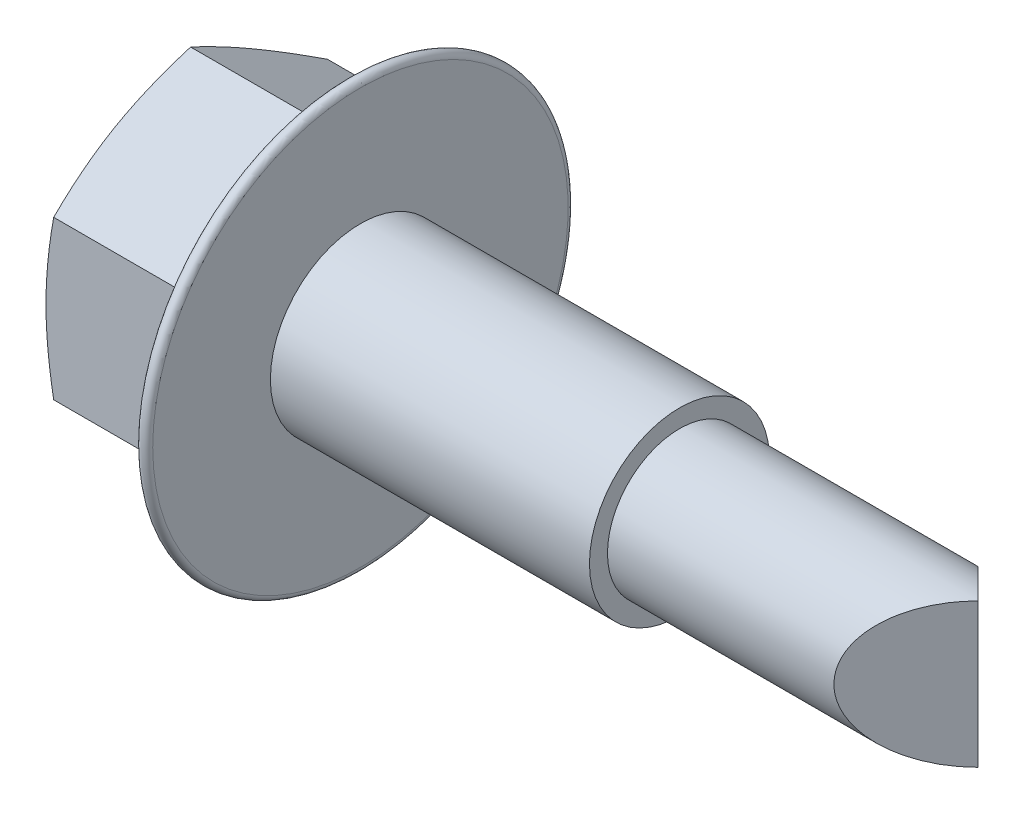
SolidWorks part; units mm, degrees
ref_plane "Front" through (0, 0, 0) normal (0, 0, 1) x (1, 0, 0)
ref_plane "Top" through (0, 0, 0) normal (0, 1, 0) x (1, 0, 0)
ref_plane "Right" through (0, 0, 0) normal (1, 0, 0) x (0, 0, -1)
sketch "Sketch1" plane through (0, 0, 0) normal (0, 0, 1) x (1, 0, 0)
  line L0 (-5.817, 0) -> (26.9196, 0) construction
  line L1 (0, 0) -> (0, 1.75)
  line L2 (0, 1.75) -> (6.2, 1.75)
  line L3 (6.2, 1.75) -> (6.2, 1.4)
  line L4 (6.2, 1.4) -> (12, 1.4)
  line L5 (12, 1.4) -> (12, 0)
  line L6 (12, 0) -> (0, 0)
  line L7 (1.3, 4.1877) -> (1.3, -5.1194) construction
  dimension "lg" = 6.2
  dimension "l" = 12
  dimension "d" = 3.5
  dimension "dp" = 2.8
  dimension "a" = 1.3
revolve "BaseBody" add sketch "Sketch1" angle 360 about L0
sketch "Sketch2" plane through (0, 0, 0) normal (0, 1, 0) x (1, 0, 0)
  line L0 (11.6965, 0) -> (13.6929, 0) construction
  line L2 (12.4565, -10) -> (12.4565, 10)
  line L3 (12.4565, 10) -> (2, 10)
  line L4 (2, 10) -> (12, 0)
  line L6 (2, -10) -> (12, 0)
  line L7 (12.4565, -10) -> (2, -10)
  line L8 (12, -1.4) -> (12, 1.4) construction
  point P12 (12.4565, 0)
  dimension "D1" = 45
  dimension "D2" = 10
  dimension "D3" = 0.4565
extrude "Cut-Extrude1" cut sketch "Sketch2" against normal through all and the other way through all
sketch "Sketch3" plane through (0, 0, 0) normal (1, 0, 0) x (0, 0, -1)
  line L1 (0, -3.0715) -> (2.66, -1.5358)
  line L2 (2.66, -1.5358) -> (2.66, 1.5358)
  line L3 (2.66, 1.5358) -> (0, 3.0715)
  line L4 (0, 3.0715) -> (-2.66, 1.5358)
  line L5 (-2.66, 1.5358) -> (-2.66, -1.5358)
  line L6 (-2.66, -1.5358) -> (0, -3.0715)
  circle A0 centre (0, 0) radius 2.66 construction
  dimension "D1" = 5.32
extrude "BaseHead" add sketch "Sketch3" against normal blind 3.45
sketch "Sketch4" plane through (0, 0, 0) normal (0, 1, 0) x (1, 0, 0)
  line L0 (-3.45, 15) -> (-3.45, 2.66)
  line L1 (-3.45, 2.66) -> (1.0414, 15)
  line L2 (1.0414, 15) -> (-3.45, 15)
  line L3 (0, 0) -> (-8.4371, 0) construction
  line L6 (-3.45, 0) -> (-3.45, 2.66) construction
  dimension "D1" = 20
  dimension "s" = 5.32
  dimension "D3" = 30
revolve "Cut-Revolve1" cut sketch "Sketch4" angle 360 about L3
sketch "Sketch5" plane through (0, 0, 0) normal (0, 1, 0) x (1, 0, 0)
  line L0 (-28.7244, 0) -> (3.8463, 0) construction
  line L2 (0, 0) -> (0, 4.0364)
  line L3 (-0.2233, 4.0658) -> (-1.3127, 0)
  line L6 (0, 0) -> (-1.3127, 0)
  arc A0 (0, 4.0364) -> (-0.2233, 4.0658) centre (-0.1136, 4.0364) ccw
  point P6 (-0.6, 2.66)
  dimension "D1" = 75
  dimension "c" = 0.6
  dimension "D2" = 2.66
  dimension "dc" = 8.3
revolve "Revolve2" add sketch "Sketch5" angle 360 about L0
fillet "Fillet1" [suppressed] radius 0.5
fillet "Fillet2" radius 0.2 6 edges
sketch "Sketch6" plane through (0, 0, 0) normal (0, 0, 1) x (1, 0, 0)
  line L0 (0, 0) -> (8.1294, 0) construction
  line L1 (1.0979, 2.1541) -> (1.5021, 2.1541)
  line L2 (1.5021, 1.75) -> (1.3, 1.4)
  line L3 (1.3, 1.4) -> (1.0979, 1.75)
  line L4 (1.0979, 1.75) -> (1.0979, 2.1541)
  line L5 (1.5021, 2.1541) -> (1.5021, 1.75)
  line L6 (0, -4.0364) -> (0, 4.0364) construction
  dimension "D1" = 2.8
  dimension "D2" = 3.5
  dimension "D3" = 1.3
revolve "Cut-Revolve10" [suppressed] cut sketch "Sketch6" angle 360 about L0
pattern_linear "LPattern10" [suppressed] count 10 spacing 0.525 along (1, 0, 0)
sketch "Sketch7" plane through (0, 0, 0) normal (0, 1, 0) x (1, 0, 0)
  line L0 (-3.45, 0) -> (-6.4074, 0) construction
  line L1 (-3.45, 0) -> (-3.0188, 0)
  line L2 (-3.45, 0) -> (-3.45, 2.2167)
  line L3 (-3.45, 2.2167) -> (-3.0188, 2.2167)
  line L4 (-3.0188, 0) -> (-3.0188, 2.2167)
  line L5 (-3.45, 1.33) -> (-3.45, -1.33) construction
  dimension "D1" = 4.4333
  dimension "D2" = 0.4313
revolve "Cut-Revolve11" cut sketch "Sketch7" angle 360 about L0
equation "\"D1@ThreadCosmetic1\" = \"lg@Sketch1\""
equation "\"D2@ThreadCosmetic1\" = \"dp@Sketch1\""
equation "\"D1@Sketch3\" =\"s@Sketch4\""
equation "\"D2@Sketch5\" = \"D1@Sketch3\" / 2"
equation "\"D1@Sketch6\" = \"dp@Sketch1\""
equation "\"D2@Sketch6\" = \"d@Sketch1\""
equation "\"D3@Sketch6\" = \"a@Sketch1\""
equation "\"D3@LPattern10\" = (\"d@Sketch1\"-\"dp@Sketch1\") / 2*1.5"
equation "\"D1@LPattern10\" = (  \"lg@Sketch1\" - \"a@Sketch1\" )  / \"D3@LPattern10\" + 1"
equation "\"D1@Sketch7\" = \"D1@Sketch3\" * 5 / 6"
equation "\"D2@Sketch7\" = \"k@BaseHead\" / 8"
